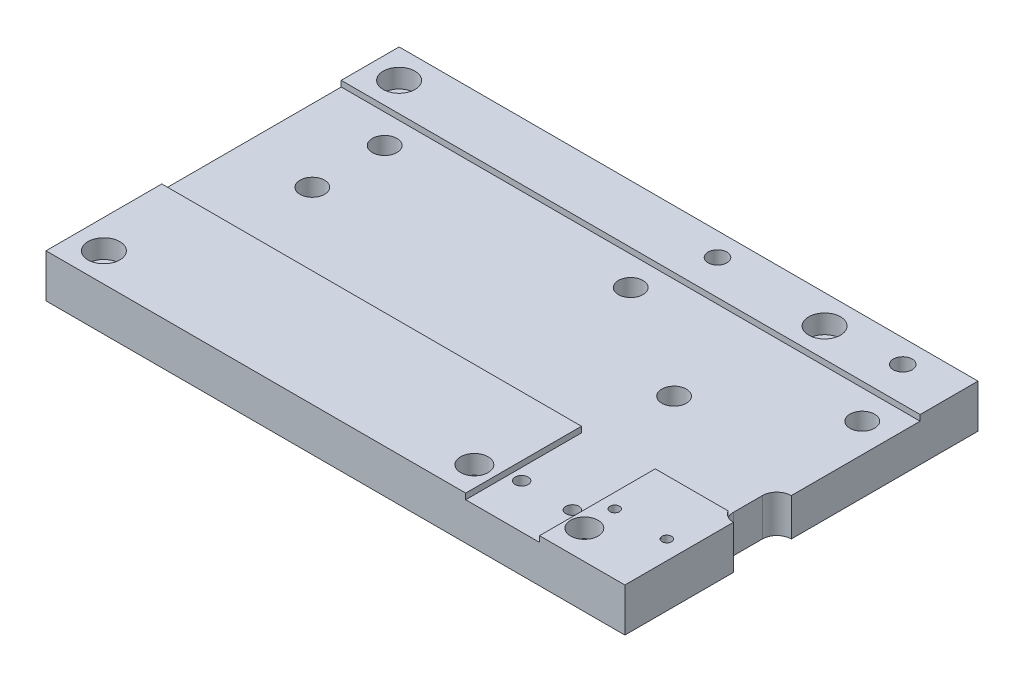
SolidWorks part; units mm, degrees
ref_plane "前视基准面" through (0, 0, 0) normal (0, 0, 1) x (1, 0, 0)
ref_plane "上视基准面" through (0, 0, 0) normal (0, 1, 0) x (1, 0, 0)
ref_plane "右视基准面" through (0, 0, 0) normal (1, 0, 0) x (0, 0, -1)
sketch "草图1" plane through (0, 0, 0) normal (0, 0, 1) x (1, 0, 0)
  line L0 (200, 0) -> (200, 15)
  line L1 (0, 0) -> (0, 15)
  line L2 (0, 0) -> (200, 0)
  line L3 (0, 15) -> (200, 15)
extrude "凸台-拉伸1" add sketch "草图1" along normal blind 122
sketch "草图2" plane through (200, 0, 0) normal (1, 0, 0) x (0, 0, -1)
  line L0 (-20, 13) -> (-82, 13)
  line L1 (-82, 13) -> (-82, 23.0832)
  line L2 (-82, 23.0832) -> (-20, 23.0832)
  line L3 (-20, 23.0832) -> (-20, 13)
extrude "切除-拉伸1" cut sketch "草图2" against normal through all
sketch "草图3" plane through (0, 15, 0) normal (0, 1, 0) x (1, 0, 0)
  line L0 (170.5, -122) -> (170.5, -82)
  line L1 (145, -82) -> (145, -122)
  line L2 (145, -82) -> (170.5, -82)
  line L3 (145, -122) -> (170.5, -122)
extrude "切除-拉伸2" cut sketch "草图3" against normal blind 2
sketch "草图4" plane through (0, 15, 0) normal (0, 1, 0) x (1, 0, 0)
  line L0 (195, -79.5) -> (195, -69.5)
  line L1 (200, -64.5) -> (200, -84.5)
  circle A0 centre (166.5, -106.65) radius 2.25
  circle A1 centre (149, -106.65) radius 2.25
  circle A2 centre (110, -30) radius 4.25
  circle A3 centre (190, -30) radius 4.25
  circle A4 centre (150, -55) radius 4.25
  circle A5 centre (118, -8) radius 3.25
  circle A6 centre (182, -8) radius 3.25
  circle A7 centre (25, -30) radius 4.25
  circle A8 centre (25, -55) radius 4.25
  arc A9 (200, -64.5) -> (195, -69.5) centre (200, -69.5) ccw
  arc A10 (195, -79.5) -> (200, -84.5) centre (200, -79.5) ccw
  circle A11 centre (157, -10) radius 3.25
  circle A12 centre (138, -112) radius 2.75
  circle A13 centre (176, -112) radius 2.75
  circle A14 centre (10, -10) radius 3.25
  circle A15 centre (10, -112) radius 3.25
  circle A16 centre (193.5, -101) radius 1.65
  circle A17 centre (175.5, -101) radius 1.65
extrude "切除-拉伸3" cut sketch "草图4" against normal through all
sketch "草图5" plane through (0, 15, 0) normal (0, 1, 0) x (1, 0, 0)
  circle A0 centre (157, -10) radius 5.5
  circle A1 centre (138, -112) radius 4.75
  circle A2 centre (176, -112) radius 4.75
  circle A3 centre (10, -10) radius 5.5
  circle A4 centre (10, -112) radius 5.5
extrude "切除-拉伸4" cut sketch "草图5" against normal blind 6.5
sketch "草图6" plane through (0, 13, 0) normal (0, 1, 0) x (1, 0, 0)
  circle A0 centre (166.5, -106.65) radius 4 construction
  circle A1 centre (149, -106.65) radius 4 construction
  circle A2 centre (110, -30) radius 7 construction
  circle A3 centre (190, -30) radius 7 construction
  circle A4 centre (150, -55) radius 7 construction
  circle A5 centre (118, -8) radius 5.5 construction
  circle A6 centre (182, -8) radius 5.5 construction
  circle A7 centre (25, -30) radius 7 construction
  circle A8 centre (25, -55) radius 7 construction
sketch "草图7" plane through (0, 0, 0) normal (0, -1, 0) x (1, 0, 0)
  circle A0 centre (25, 55) radius 7
  circle A1 centre (25, 30) radius 7
  circle A2 centre (110, 30) radius 7
  circle A3 centre (118, 8) radius 5.5
  circle A4 centre (150, 55) radius 7
  circle A5 centre (190, 30) radius 7
  circle A6 centre (182, 8) radius 5.5
  circle A7 centre (149, 106.65) radius 4
  circle A8 centre (166.5, 106.65) radius 4
extrude "切除-拉伸5" cut sketch "草图7" against normal blind 6.5
